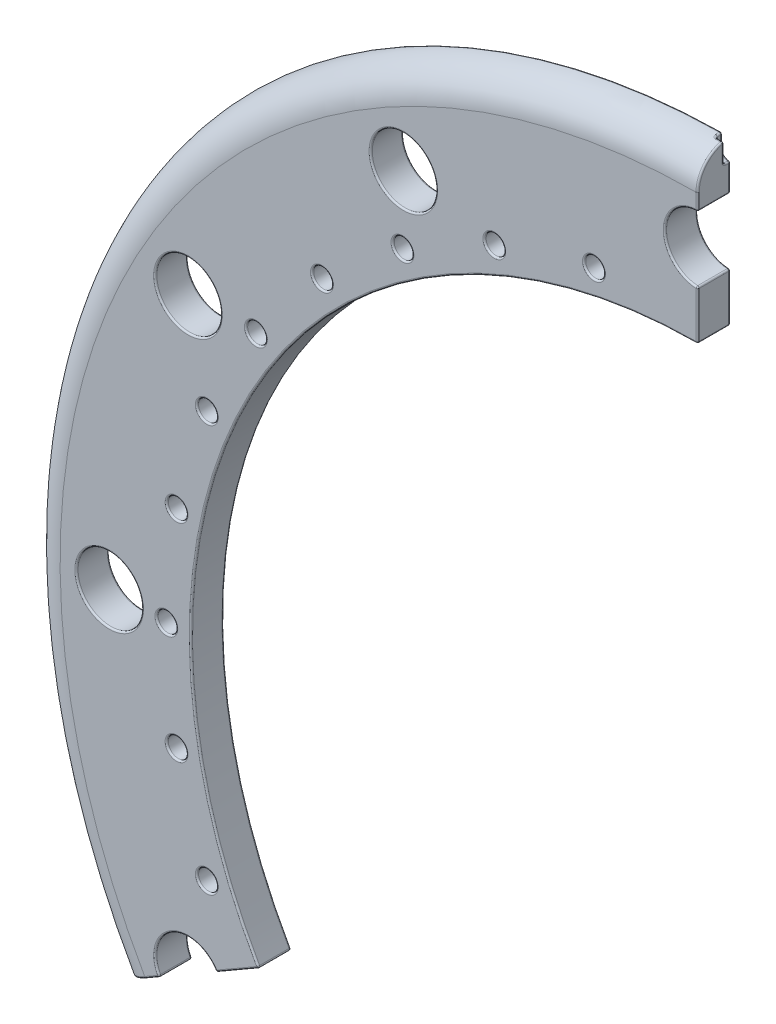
SolidWorks part; units mm, degrees
ref_plane "Спереди" through (0, 0, 0) normal (0, 0, 1) x (1, 0, 0)
ref_plane "Сверху" through (0, 0, 0) normal (0, 1, 0) x (1, 0, 0)
ref_plane "Справа" through (0, 0, 0) normal (1, 0, 0) x (0, 0, -1)
sketch "Эскиз1" plane through (0, 0, 0) normal (0, 0, 1) x (1, 0, 0)
  line L0 (0, 0) -> (0, 205) construction
  line L1 (0, 0) -> (-177.5352, -102.5) construction
  line L2 (0, 0) -> (-102.5, 177.5352) construction
  line L3 (-205, 0) -> (0, 0) construction
  line L4 (0, 0) -> (-177.5352, 102.5) construction
  line L5 (0, 205) -> (0, 190)
  line L6 (0, 170) -> (0, 155)
  line L7 (-177.5352, -102.5) -> (-164.5448, -95)
  line L8 (-147.2243, -85) -> (-134.2339, -77.5)
  line L9 (0, 0) -> (-31.7022, 159.3776) construction
  line L10 (0, 0) -> (-31.7022, 159.3776) construction
  line L11 (0, 0) -> (-62.1861, 150.1304) construction
  arc A0 (0, 205) -> (-177.5352, -102.5) centre (0, 0) ccw
  arc A1 (0, 155) -> (-134.2339, -77.5) centre (0, 0) ccw
  arc A2 (0, 180) -> (-155.8846, -90) centre (0, 0) ccw construction
  arc A3 (0, 190) -> (0, 170) centre (0, 180) ccw
  circle A4 centre (-90, 155.8846) radius 10
  circle A5 centre (-155.8846, 90) radius 10
  circle A6 centre (-180, 0) radius 10
  arc A7 (-147.2243, -85) -> (-164.5448, -95) centre (-155.8846, -90) ccw
  circle A8 centre (0, 0) radius 205 construction
  circle A9 centre (0, 0) radius 180 construction
  circle A10 centre (0, 0) radius 155 construction
  circle A11 centre (0, 0) radius 162.5 construction
  circle A12 centre (-31.7022, 159.3776) radius 3
  circle A13 centre (-62.1861, 150.1304) radius 3
  circle A14 centre (-90.2802, 135.1138) radius 3
  circle A15 centre (-114.9049, 114.9049) radius 3
  circle A16 centre (-135.1138, 90.2802) radius 3
  circle A17 centre (-150.1304, 62.1861) radius 3
  circle A18 centre (-159.3776, 31.7022) radius 3
  circle A19 centre (-162.5, 0) radius 3
  circle A20 centre (-159.3776, -31.7022) radius 3
  circle A21 centre (-150.1304, -62.1861) radius 3
  point P4 (0, 162.5)
  dimension "D1" = 410
  dimension "D8" = 20
  dimension "D10" = 6
  dimension "D4" = 120
  dimension "D5" = 30
  dimension "D6" = 30
  dimension "D7" = 30
  dimension "D9" = 11.25
  dimension "D12" = 11.25
  dimension "D13" = 22.5
  dimension "D2" = 50
  dimension "D3" = 25
  dimension "D11" = 10
extrude "Бобышка-Вытянуть1" add sketch "Эскиз1" along normal mid plane 10
fillet "Скругление1" radius 10 1 edges at (-177.5352, 102.5, 5)
fillet "Скругление2" radius 0.5 49 edges at (-134.2339, 77.5, 5) (-134.2339, 77.5, -5) (-28.7022, 159.3776, -5) (-28.7022, 159.3776, 5) (-59.1861, 150.1304, -5) (-59.1861, 150.1304, 5) (-87.2802, 135.1138, -5) (-87.2802, 135.1138, 5) (-111.9049, 114.9049, -5) (-111.9049, 114.9049, 5) (-132.1138, 90.2802, -5) (-132.1138, 90.2802, 5) (-147.1304, 62.1861, -5) (-147.1304, 62.1861, 5) (-156.3776, 31.7022, -5) (-156.3776, 31.7022, 5) (-159.5, 0, -5) (-159.5, 0, 5) (-156.3776, -31.7022, -5) (-156.3776, -31.7022, 5) (-147.1304, -62.1861, -5) (-147.1304, -62.1861, 5) (-140.7291, -81.25, 5) (-134.2339, -77.5, 0) (-140.7291, -81.25, -5) (-171.04, -98.75, -5) (-174.9987, -101.0355, 2.0711) (-166.7099, -96.25, 5) (-164.5448, -95, 0) (-160.8846, -81.3397, 5) (-147.2243, -85, 0) (-160.8846, -81.3397, -5) (-170, 0, -5) (-170, 0, 5) (-145.8846, 90, -5) (-145.8846, 90, 5) (-80, 155.8846, -5) (-80, 155.8846, 5) (0, 155, 0) (0, 162.5, 5) (0, 162.5, -5) (0, 192.5, 5) (0, 202.0711, 2.0711) (0, 197.5, -5) (0, 170, 0) (-10, 180, 5) (0, 190, 0) (-10, 180, -5) (-177.5352, 102.5, -5)
sketch "Эскиз2" plane through (0, 0, 0) normal (1, 0, 0) x (0, 0, -1)
  line L7 (15, 201) -> (3, 201)
  line L8 (15, 198) -> (15, 201)
  line L10 (3, 198.6) -> (15, 198)
  line L11 (3, 201) -> (3, 198.6)
  line L12 (15, 201) -> (3, 201)
  line L13 (15, 198) -> (15, 201)
  line L14 (3, 198.6) -> (15, 198)
  line L15 (3, 201) -> (3, 198.6)
  dimension "D1" = 0
revolve "Вырез-Повернуть1" cut sketch "Эскиз2" angle 360 about L12
ref_plane "Плоскость1" through (0, 201, 0) normal (0, 1, 0) x (-1, 0, 0)
sketch "Эскиз3" plane through (0, 201, 0) normal (0, 1, 0) x (-1, 0, 0)
  line L0 (2.4, -3) -> (3, -15) construction
  line L1 (-3, -15) -> (3, -15) construction
  line L2 (-2.4, -3) -> (-3, -15) construction
  line L3 (2.4, -3) -> (-2.4, -3) construction
  line L4 (2.4, -3) -> (3, -15)
  line L5 (-3, -15) -> (3, -15)
  line L6 (-2.4, -3) -> (-3, -15)
  line L7 (2.4, -3) -> (-2.4, -3)
extrude "Вырез-Вытянуть1" cut sketch "Эскиз3" along normal through all
fillet "Скругление3" radius 0.5 11 edges at (-2.5, 202.7358, -5) (-1.9365, 199.4189, -5) (-2.4896, 204.8779, -4.7916) (-0.1939, 198.5128, -4.8953) (0, 198.5625, -3.75) (-1.4506, 204.7928, -3) (-0.1138, 204.6111, -3) (-1.6971, 199.3029, -3) (0, 201.4432, -3) (-2.4, 202.8919, -3)
